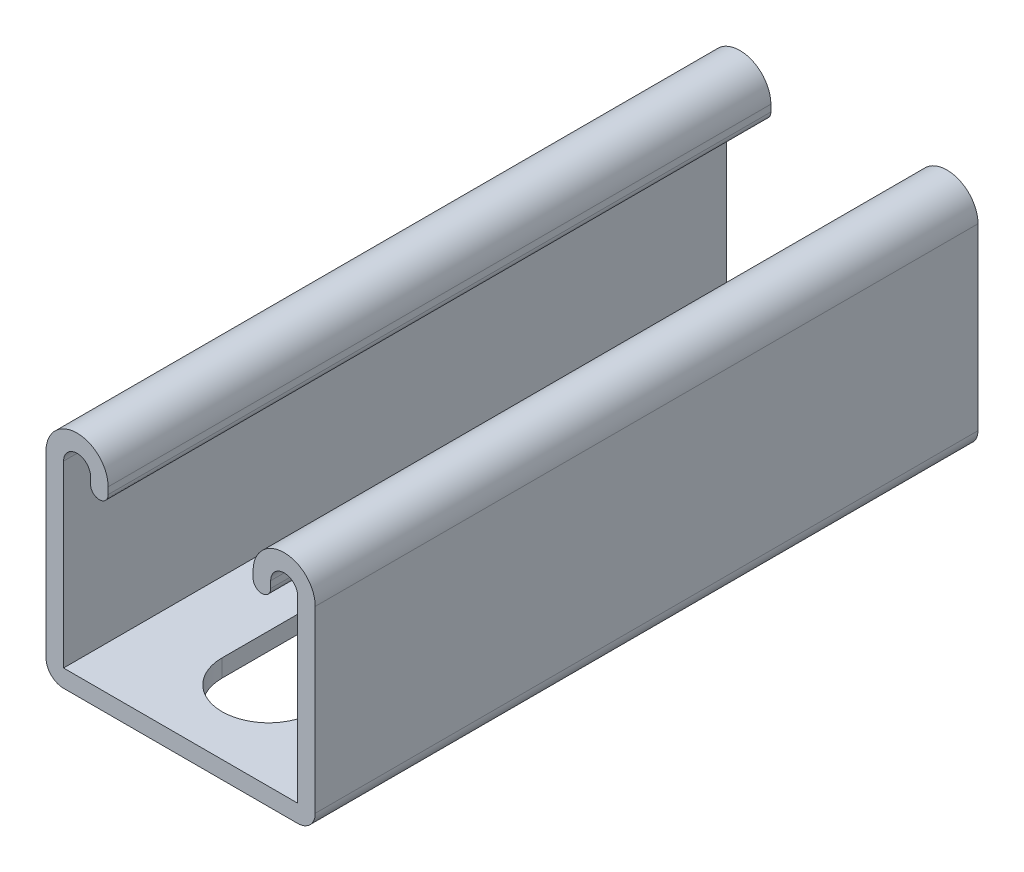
SolidWorks part; units mm, degrees
ref_plane "Plane1" through (0, 0, 0) normal (0, 0, 1) x (1, 0, 0)
ref_plane "Plane2" through (0, 0, 0) normal (0, 1, 0) x (1, 0, 0)
ref_plane "Plane3" through (0, 0, 0) normal (1, 0, 0) x (0, 0, -1)
sketch "Sketch1" plane through (0, 0, 0) normal (0, 0, 1) x (1, 0, 0)
  line L0 (-20.6375, 15.1511) -> (-20.6375, -12.319)
  line L1 (-17.9451, -15.0114) -> (17.9451, -15.0114)
  line L2 (20.6375, -12.319) -> (20.6375, 15.1511)
  line L3 (11.1125, 15.1511) -> (11.1125, 14.116)
  line L4 (-11.1125, 15.1511) -> (-11.1125, 14.116)
  line L5 (-13.8049, 15.1511) -> (-13.8049, 14.116)
  line L6 (-17.9451, 15.1511) -> (-17.9451, -12.319)
  line L7 (-17.9451, -12.319) -> (17.9451, -12.319)
  line L8 (17.9451, -12.319) -> (17.9451, 15.1511)
  line L9 (13.8049, 15.1511) -> (13.8049, 14.116)
  line L10 (-25.4, 19.9136) -> (25.4, 19.9136) construction
  line L11 (-12.8524, 12.7698) -> (12.8524, 12.7698) construction
  arc A0 (20.6375, 15.1511) -> (11.1125, 15.1511) centre (15.875, 15.1511) ccw
  arc A1 (-20.6375, 15.1511) -> (-11.1125, 15.1511) centre (-15.875, 15.1511) cw
  arc A2 (-17.9451, -15.0114) -> (-20.6375, -12.319) centre (-17.9451, -12.319) cw
  arc A3 (17.9451, -15.0114) -> (20.6375, -12.319) centre (17.9451, -12.319) ccw
  arc A4 (-17.9451, 15.1511) -> (-13.8049, 15.1511) centre (-15.875, 15.1511) cw
  arc A5 (17.9451, 15.1511) -> (13.8049, 15.1511) centre (15.875, 15.1511) ccw
  arc A6 (11.1125, 14.116) -> (13.8049, 14.116) centre (12.4587, 14.116) ccw
  arc A7 (-11.1125, 14.116) -> (-13.8049, 14.116) centre (-12.4587, 14.116) cw
  dimension "D1" = 2.6924
  dimension "D3" = 20.6375
  dimension "Width" = 41.275
  dimension "D5" = 15.0114
  dimension "D6" = 9.525
  dimension "D7" = 22.225
  dimension "D8" = 19.9136
  dimension "D9" = 7.1437
  dimension "gauge" = 2.6924
extrude "Base-Extrude" add sketch "Sketch1" along normal blind 101.6
extrude "Slot" cut sketch "Sketch2" against normal through all
sketch "Sketch2" plane through (0.7476, -15.0114, -24.0134) normal (0, -1, 0) x (1, 0, 0)
  line L0 (6.3961, 61.3197) -> (6.3961, 47.0322)
  line L1 (-7.8914, 47.0322) -> (-7.8914, 61.3197)
  arc A0 (-7.8914, 47.0322) -> (6.3961, 47.0322) centre (-0.7476, 47.0322) ccw
  arc A1 (6.3961, 61.3197) -> (-7.8914, 61.3197) centre (-0.7476, 61.3197) ccw
  dimension "D3" = 14.2875
  dimension "D1" = 23.0188
  dimension "D2" = 14.2875
pattern_linear "LPattern1" count 2 spacing 50.8 along (0, 0, 1) of "Slot"
equation "\"D3@Sketch1\" = \"Width@Sketch1\" / 2"
equation "\"D7@Sketch1\" = \"Width@Sketch1\" - 2 * \"D6@Sketch1\""
equation "\"D1@Sketch1\" = \"gauge@Sketch1\""
equation "\"D1@LPattern1\" = \"D1@Base-Extrude\" / \"D3@LPattern1\""
